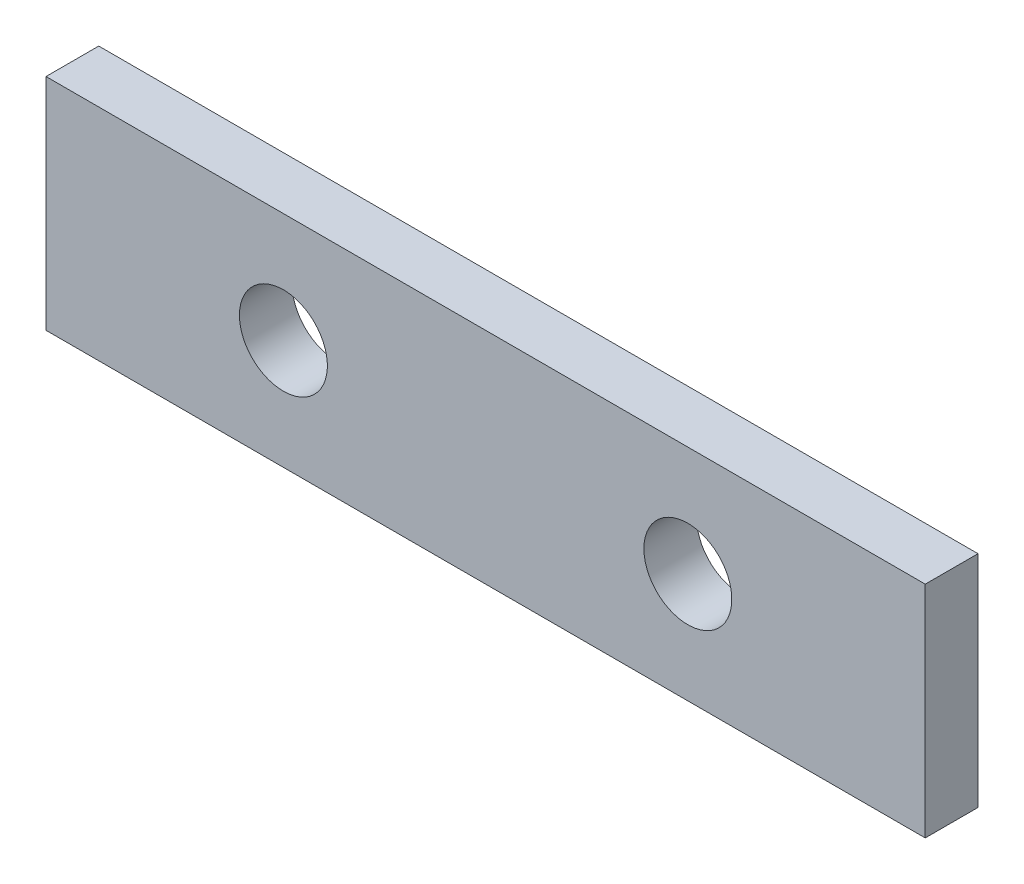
SolidWorks part; units mm, degrees
ref_plane "Face" through (0, 0, 0) normal (0, 0, 1) x (1, 0, 0)
ref_plane "Dessus" through (0, 0, 0) normal (0, 1, 0) x (1, 0, 0)
ref_plane "Droite" through (0, 0, 0) normal (1, 0, 0) x (0, 0, -1)
sketch "Esquisse1" plane through (0, 0, 0) normal (0, 0, 1) x (1, 0, 0)
  line L0 (-5.1541, -25) -> (200, -25) construction
  line L1 (0, 0) -> (200, 0)
  line L2 (0, 0) -> (0, -50)
  line L3 (0, -50) -> (200, -50)
  line L4 (200, 0) -> (200, -50)
  line L5 (100, 18.5219) -> (100, -52.4398) construction
  line L6 (146, 13.7912) -> (146, -50.4479) construction
  line L7 (54, 11.9195) -> (54, -50.4479) construction
  circle A0 centre (146, -25) radius 10
  circle A1 centre (54, -25) radius 10
  dimension "D5" = 25
  dimension "D6" = 20
  dimension "D7" = 92
  dimension "D8" = 20
  dimension "D1" = 200
  dimension "D2" = 50
  dimension "D3" = 100
  dimension "D4" = 46
extrude "Extrusion1" add sketch "Esquisse1" along normal blind 12
